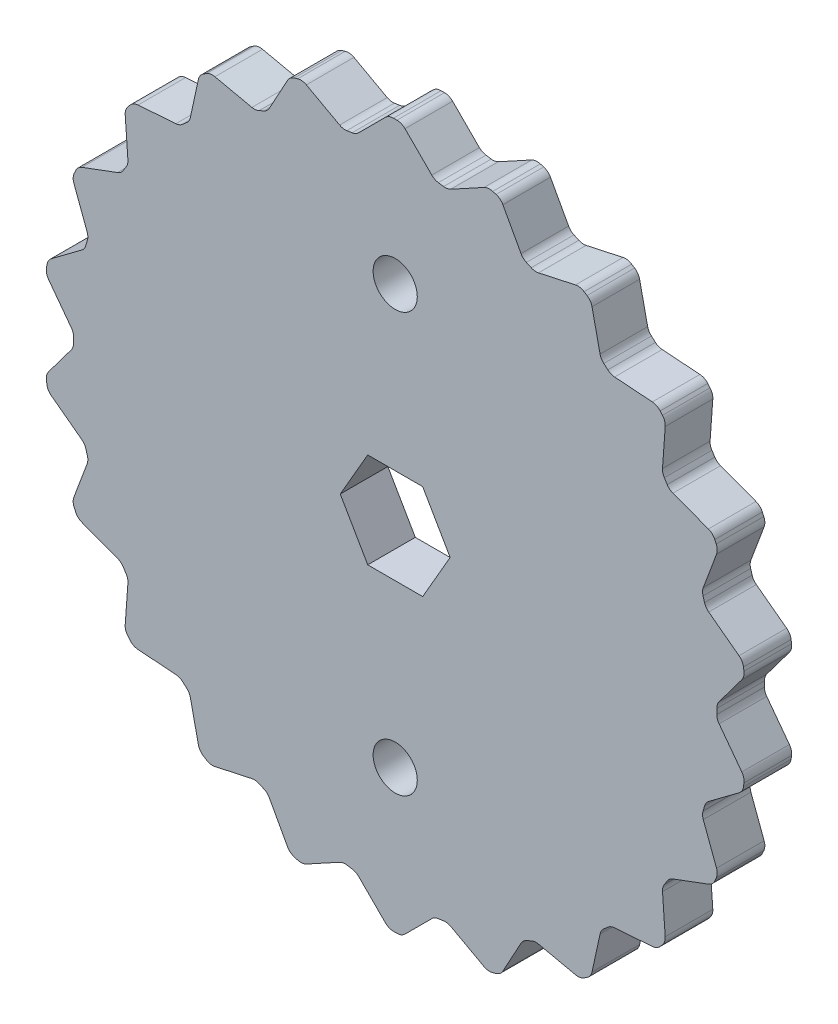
SolidWorks part; units mm, degrees
ref_plane "Front Plane" through (0, 0, 0) normal (0, 0, 1) x (1, 0, 0)
ref_plane "Top Plane" through (0, 0, 0) normal (0, 1, 0) x (1, 0, 0)
ref_plane "Right Plane" through (0, 0, 0) normal (1, 0, 0) x (0, 0, -1)
sketch "Sketch2" plane through (0, 0, 0) normal (0, 0, 1) x (1, 0, 0)
  line L0 (0, 0) -> (0, 44.1565) construction
  line L1 (0, 0) -> (-6.3021, 43.8421) construction
  line L2 (0.4318, 23.4889) -> (-0.4318, 23.4889)
  line L3 (-0.4318, 23.4889) -> (-2.625, 21.2958)
  line L4 (0.4318, 23.4889) -> (2.625, 21.2958)
  circle A0 centre (0, 0) radius 21.4569 construction
  arc A1 (-2.625, 21.2958) -> (-3.053, 21.2386) centre (0, 0) ccw
  arc A2 (2.625, 21.2958) -> (3.053, 21.2386) centre (0, 0) cw
  arc A3 (-3.053, 21.2386) -> (3.053, 21.2386) centre (0, 21.4569) ccw
  point P3 (0, 21.4569)
  point P11 (0, 23.4889)
  dimension "D1" = 8.18
  dimension "D5" = 0.4318
  dimension "D2" = 0.4318
  dimension "D3" = 2.032
  dimension "D4" = 45
extrude "Boss-Extrude1" add sketch "Sketch2" along normal blind 3.175
sketch "Sketch3" plane through (0, 0, 0) normal (0, 0, 1) x (1, 0, 0)
  circle A0 centre (0, 0) radius 21.4569
  arc A1 (-2.625, 21.2958) -> (-3.053, 21.2386) centre (0, 0) ccw construction
extrude "Boss-Extrude2" add sketch "Sketch3" along normal blind 3.175
fillet "Fillet1" radius 0.762 4 edges at (2.625, 21.2958, 1.5875) (0.4318, 23.4889, 1.5875) (-0.4318, 23.4889, 1.5875) (-2.625, 21.2958, 1.5875)
pattern_circular "CirPattern1" count 22 over 360 about axis through (0, 0, 0) along (0, 0, 1) of "Fillet1", "Boss-Extrude1"
sketch "Sketch4" plane through (0, 0, 3.175) normal (0, 0, 1) x (1, 0, 0)
  line L1 (1.8331, -3.175) -> (3.6662, 0)
  line L2 (3.6662, 0) -> (1.8331, 3.175)
  line L3 (1.8331, 3.175) -> (-1.8331, 3.175)
  line L4 (-1.8331, 3.175) -> (-3.6662, 0)
  line L5 (-3.6662, 0) -> (-1.8331, -3.175)
  line L6 (-1.8331, -3.175) -> (1.8331, -3.175)
  circle A0 centre (0, 0) radius 3.175 construction
  dimension "D1" = 6.35
extrude "Cut-Extrude1" cut sketch "Sketch4" against normal through all
hole_wizard "#4 Clearance Hole1" positions "Sketch6" profile "Sketch5" hole size "#4" standard "ANSI Inch"
sketch "Sketch6" plane through (0, 0, 3.175) normal (0, 0, 1) x (1, 0, 0)
  point P0 (0, 13.97)
  point P2 (0, -13.97)
  dimension "D1" = 13.97
  dimension "D2" = 13.97
sketch "Sketch5" plane through (0, 13.97, 3.175) normal (1, 0, 0) x (0, -1, 0)
  line L0 (0, 0) -> (0, 3.175)
  line L1 (0, 3.175) -> (1.4732, 3.175)
  line L2 (1.4732, 3.175) -> (1.4732, 0)
  line L5 (1.4732, 0) -> (0, 0)
  line L11 (0, -6.35) -> (0, 107.95) construction
  dimension "Thru Hole Dia." = 2.9464
  dimension "Thru Hole Depth" = 3.175
